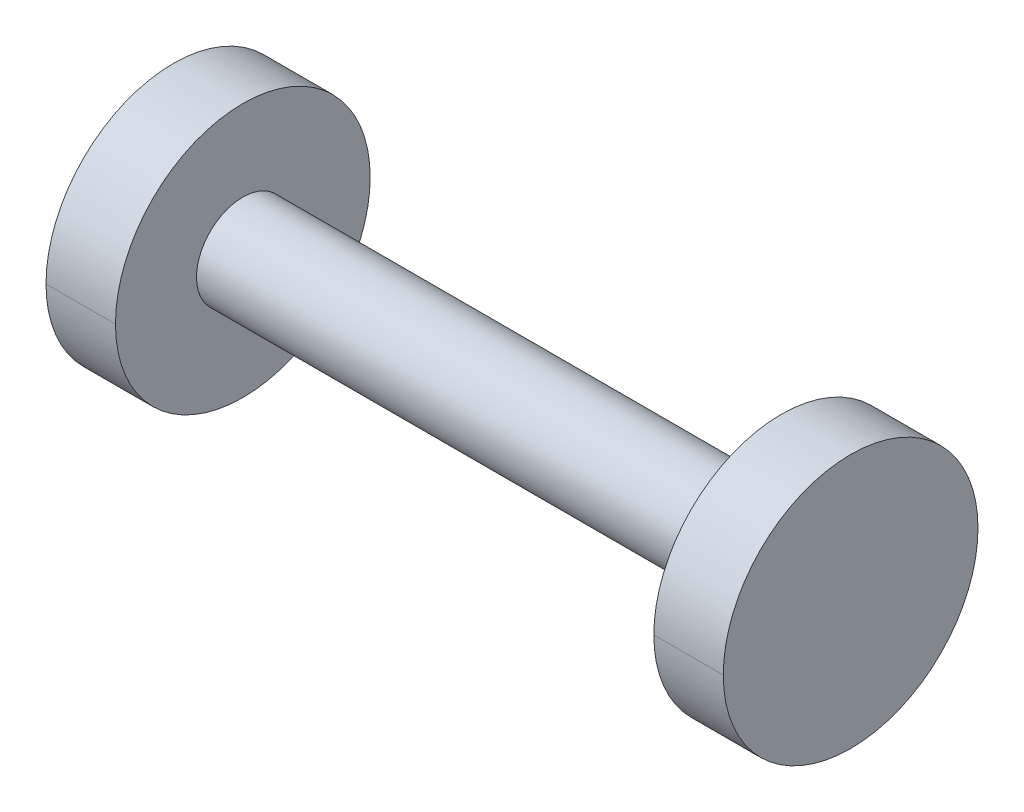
SolidWorks part; units mm, degrees
ref_plane "Plan de face" through (0, 0, 0) normal (0, 0, 1) x (1, 0, 0)
ref_plane "Plan de dessus" through (0, 0, 0) normal (0, 1, 0) x (1, 0, 0)
ref_plane "Plan de droite" through (0, 0, 0) normal (1, 0, 0) x (0, 0, -1)
sketch "Esquisse1" plane through (0, 0, 0) normal (0, 0, 1) x (1, 0, 0)
  line L0 (0, 0) -> (-58.5, 0) construction
  line L1 (0, 0) -> (0, 11)
  line L2 (0, 11) -> (-6, 11)
  line L3 (-6, 11) -> (-6, 4)
  line L4 (-6, 4) -> (-52.5, 4)
  line L5 (-52.5, 4) -> (-52.5, 11)
  line L6 (-52.5, 11) -> (-58.5, 11)
  line L7 (-58.5, 11) -> (-58.5, 0)
  line L8 (-58.5, 0) -> (0, 0)
  line L9 (-58.5, 0) -> (-78.6412, 0) construction
  dimension "D1" = 6
  dimension "D2" = 6
  dimension "D3" = 46.5
  dimension "D4" = 11
  dimension "D5" = 8
  dimension "D6" = 11
revolve "Révolution1" add sketch "Esquisse1" angle 360 about L9
ref_plane "Plan1" through (-29.25, 0, 0) normal (1, 0, 0) x (0, 0, -1)
sketch "Esquisse3" plane through (-29.25, 0, 0) normal (1, 0, 0) x (0, 0, -1)
  line L0 (0, 11) -> (0, -11) construction
  arc A0 (11, 0) -> (-11, 0) centre (0, 0) ccw construction
  arc A1 (-11, 0) -> (11, 0) centre (0, 0) ccw construction
sketch "Esquisse4" plane through (-29.25, 0, 0) normal (1, 0, 0) x (0, 0, -1)
  point P0 (0, 0)
sketch "Esquisse5" plane through (-29.25, 0, 0) normal (1, 0, 0) x (0, 0, -1)
  line L0 (-12.0357, 0) -> (11, 0) construction
